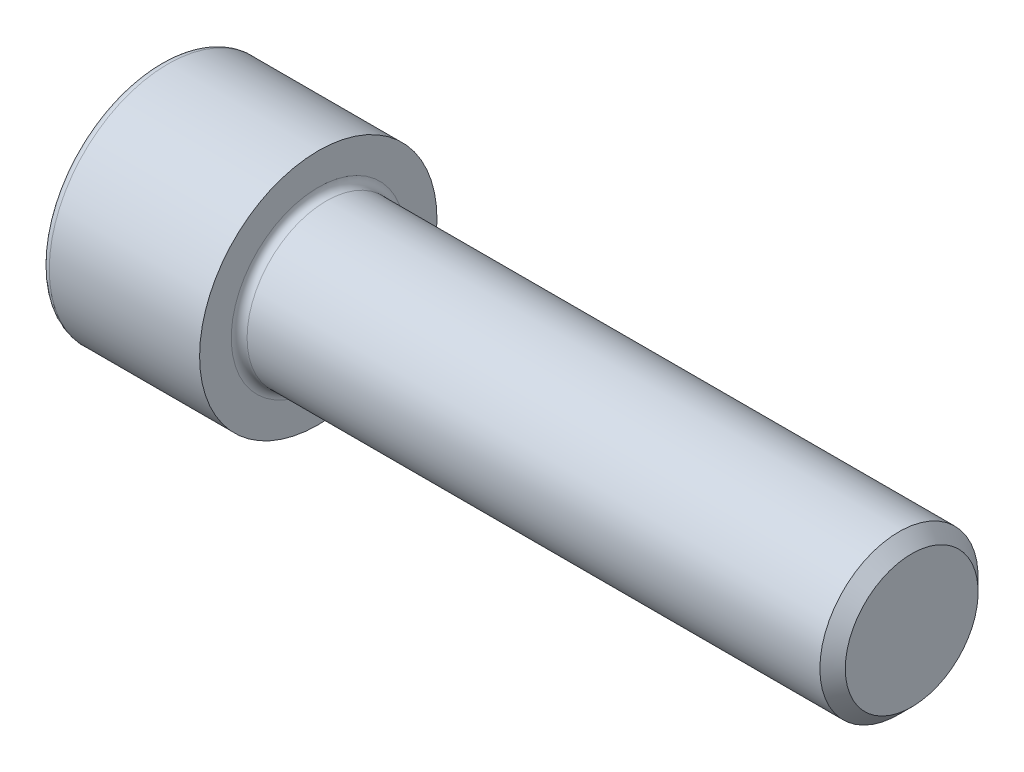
SolidWorks part; units mm, degrees
ref_plane "Plane1" through (0, 0, 0) normal (0, 0, 1) x (1, 0, 0)
ref_plane "Plane2" through (0, 0, 0) normal (0, 1, 0) x (1, 0, 0)
ref_plane "Plane3" through (0, 0, 0) normal (1, 0, 0) x (0, 0, -1)
sketch "BodySke" plane through (0, 0, 0) normal (0, 0, 1) x (1, 0, 0)
  line L0 (0, 0) -> (0, 9)
  line L1 (0, 9) -> (12, 9)
  line L2 (12, 9) -> (12, 6)
  line L3 (12, 6) -> (56.036, 6)
  line L4 (57, 5.036) -> (57, 0)
  line L5 (57, 0) -> (0, 0)
  line L6 (-31.75, 0) -> (127, 0) construction
  line L8 (57, 5.036) -> (56.036, 6)
  line L10 (57, -5.036) -> (56.036, -6) construction
  line L11 (13.75, 9.525) -> (13.75, 3.175) construction
  line L12 (12, 9.525) -> (12, 3.175) construction
  line L13 (-3, 9.525) -> (-3, 3.175) construction
  dimension "Diameter" = 12
  dimension "Head_ht" = 12
  dimension "Length" = 45
  dimension "Body_ch_ang" = 45
  dimension "Head_dia" = 18
  dimension "Minor_dia" = 10.072
  dimension "Advance" = 1.75
  dimension "Thread_nom" = 45
  dimension "Thread_length" = 60
revolve "Base-Revolve" add sketch "BodySke"
fillet "Fillet1" radius 0.6 1 edges at (12, 0, 6)
fillet "Fillet2" radius 0.6 1 edges at (0, 0, 9)
sketch "Sketch2" plane through (0, 0, 0) normal (0, 0, 1) x (1, 0, 0)
  line L0 (0, 5.0575) -> (6, 5.0575)
  line L1 (6, 5.0575) -> (8.9199, 0)
  line L2 (-31.75, 0) -> (127, 0) construction
  line L3 (8.9199, 0) -> (0, 0)
  line L4 (0, 0) -> (0, 5.0575)
  line L6 (0, 0) -> (47.625, 0) construction
  dimension "D1" = 5.0575
  dimension "D2" = 60
  dimension "Depth" = 6
revolve "Hex-PreBroach" cut sketch "Sketch2" angle 360 about L6
sketch "Sketch3" plane through (0, 0, 0) normal (-1, 0, 0) x (0, 0.5, 0.866)
  line L0 (2.9199, 5.0575) -> (-2.9199, 5.0575)
  line L1 (-2.9199, 5.0575) -> (-5.8399, 0)
  line L2 (2.9199, 5.0575) -> (5.8399, 0)
  line L3 (2.9199, -5.0575) -> (5.8399, 0)
  line L4 (2.9199, -5.0575) -> (-2.9199, -5.0575)
  line L5 (-2.9199, -5.0575) -> (-5.8399, 0)
  dimension "D1" = 5.0575
  dimension "D2" = 5.0575
  dimension "Hex_size" = 10.115
extrude "Hex" cut sketch "Sketch3" against normal blind 6
sketch "ThdSchSke" plane through (0, 0, 0) normal (0, 0, 1) x (1, 0, 0)
  line L0 (17.25, -5.036) -> (16.575, -6)
  line L1 (17.25, -5.036) -> (17.925, -6)
  line L2 (17.925, -6) -> (17.925, -7.5)
  line L3 (-3.175, 0) -> (5.1513, 0) construction
  line L4 (0, 8.4) -> (0, -8.4) construction
  line L5 (17.925, -7.5) -> (16.575, -7.5)
  line L6 (16.575, -7.5) -> (16.575, -6)
  dimension "Thread_minor" = 10.072
  dimension "Diameter" = 12
  dimension "Start" = 17.25
  dimension "SideAngle" = 55
  dimension "VeeAngle" = 70
  dimension "Overcut" = 15
revolve "ThreadSchematic" [suppressed] cut sketch "ThdSchSke" angle 360 about L3
pattern_linear "ThdSchPat" [suppressed]
equation "\"D2@Sketch3\" = \"Hex_size@Sketch3\" / 2"
equation "\"D1@Sketch3\" = \"Hex_size@Sketch3\" / 2"
equation "\"D1@Sketch2\" = \"Hex_size@Sketch3\" / 2"
equation "\"Thread_minor@ThreadCosmetic\"  =  \"Minor_dia@BodySke\""
equation "\"Depth@Sketch2\" =  \"Key_eng@Hex\""
equation "\"Thread_length@ThreadCosmetic\" = ((sgn( (\"Length@BodySke\" - \"Advance@BodySke\" * 3.0) - \"Thread_nom@BodySke\" )-1)*( (\"Length@BodySke\" - \"Advance@BodySke\" * 3.0) - \"Thread_nom@BodySke\" ))/-2+ \"Thread_no"
equation "\"Thread_minor@ThdSchSke\" = \"Minor_dia@BodySke\""
equation "\"Diameter@ThdSchSke\" = \"Diameter@BodySke\""
equation "\"Overcut@ThdSchSke\" = \"Diameter@BodySke\" * 1.25"
equation "\"Start@ThdSchSke\" = \"Head_ht@BodySke\" + \"Length@BodySke\" - \"Thread_length@ThreadCosmetic\"  '---Non-countersunk---"
equation "\"Num_threads@ThdSchPat\" = int( \"Thread_length@ThreadCosmetic\" / \"Advance@BodySke\" + 0.999 )  + 1"
equation "\"Advance@ThdSchPat\" = \"Thread_length@ThreadCosmetic\" /  (\"Num_threads@ThdSchPat\" - 1) 'relax it"
equation "\"Num_threads@ThdSchPat\" = \"Num_threads@ThdSchPat\" - sgn( \"Num_threads@ThdSchPat\" - 1) '---chamfered tips only---"
